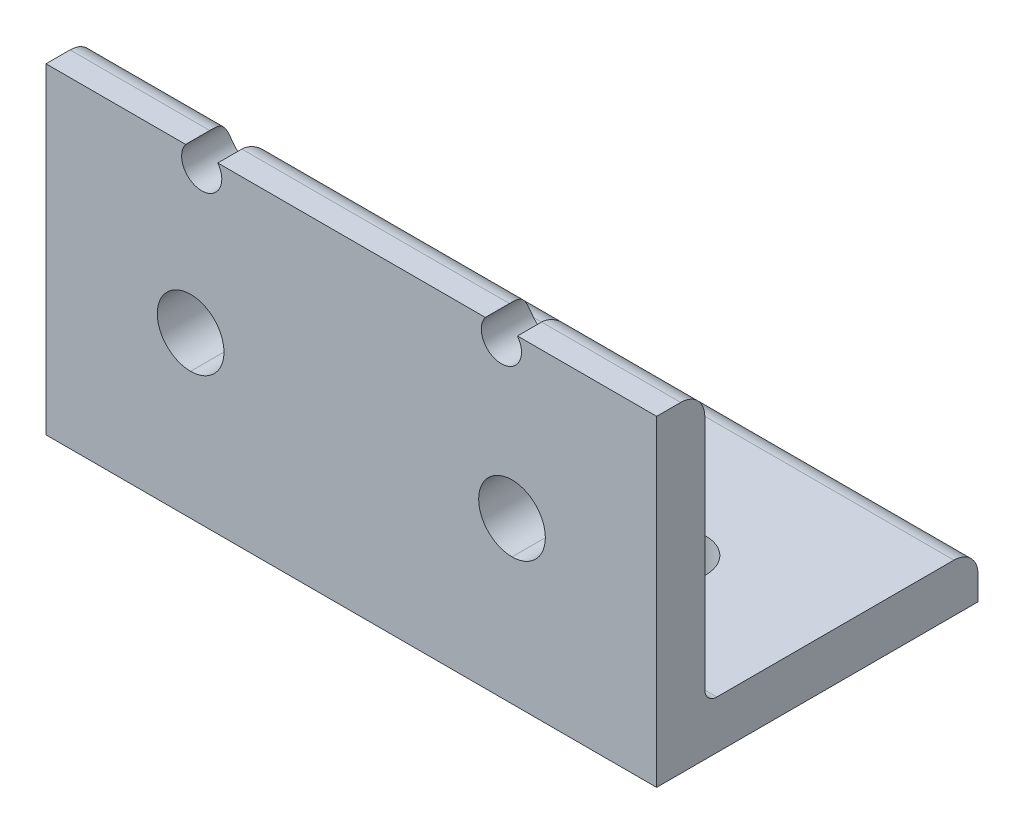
SolidWorks part; units mm, degrees
ref_plane "Front Plane" through (0, 0, 0) normal (0, 0, 1) x (1, 0, 0)
ref_plane "Top Plane" through (0, 0, 0) normal (0, 1, 0) x (1, 0, 0)
ref_plane "Right Plane" through (0, 0, 0) normal (1, 0, 0) x (0, 0, -1)
ref_plane "RIGHT" through (0, 0, 0) normal (1, 0, 0) x (0, 1, 0)
ref_plane "TOP" through (0, 0, 0) normal (0, 1, 0) x (0, 0, 1)
ref_plane "FRONT" through (0, 0, 0) normal (0, 0, 1) x (1, 0, 0)
imported_body "Imported1"
sketch "Sketch1" plane through (0, 0, 0) normal (0, 0, 1) x (1, 0, 0)
  circle A0 centre (56.6796, 38.5) radius 2.5
  circle A1 centre (19.3796, 38.5) radius 2.5
extrude "Cut-Extrude1" cut sketch "Sketch1" against normal through all
